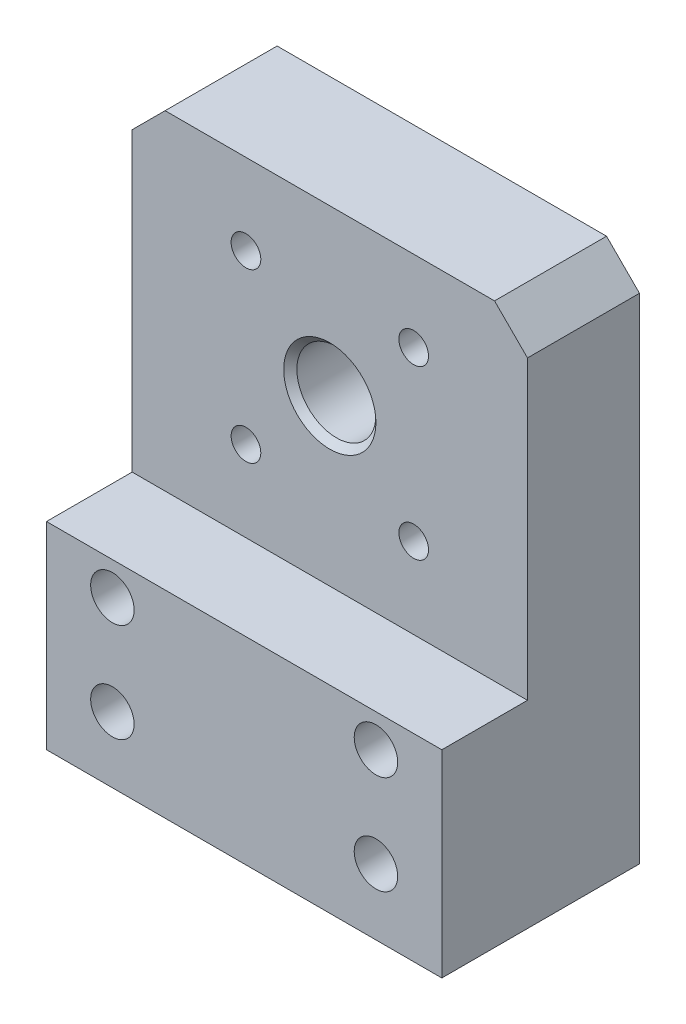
SolidWorks part; units mm, degrees
ref_plane "Face" through (0, 0, 0) normal (0, 0, 1) x (1, 0, 0)
ref_plane "Dessus" through (0, 0, 0) normal (0, 1, 0) x (1, 0, 0)
ref_plane "Droite" through (0, 0, 0) normal (1, 0, 0) x (0, 0, -1)
sketch "Esquisse1" plane through (0, 0, 0) normal (0, 0, 1) x (1, 0, 0)
  line L0 (-30, 25) -> (30, -25) construction
  line L1 (-30, 25) -> (30, 25)
  line L2 (-30, 25) -> (-30, -25)
  line L3 (-30, -25) -> (30, -25)
  line L4 (30, 25) -> (30, -25)
  circle A1 centre (0, 0) radius 6
  dimension "D1" = 60
  dimension "D2" = 12
  dimension "D3" = 50
extrude "Extrusion2" add sketch "Esquisse1" along normal mid plane 17
sketch "Esquisse3" plane through (0, 0, -8.5) normal (0, 0, -1) x (-1, 0, 0)
  line L0 (30, -25) -> (-30, -25) construction
  line L1 (-30, -55) -> (30, -55)
  line L2 (-30, -55) -> (-30, -25)
  line L3 (-30, -25) -> (30, -25)
  line L4 (30, -55) -> (30, -25)
  line L5 (-30, -25) -> (-30, 25) construction
  line L6 (30, 25) -> (30, -25) construction
  dimension "D1" = 30
extrude "Extrusion3" add sketch "Esquisse3" against normal blind 30
hole_wizard "Chambrage pour vis à tête hexagonale M61" positions "Esquisse5" profile "Esquisse4" counterbore size "M6" standard "ISO"
sketch "Esquisse5" plane through (0, 0, -8.5) normal (0, 0, -1) x (-1, 0, 0)
  line L0 (0, -30) -> (0, 0) construction
  line L1 (-20, -30) -> (20, -30) construction
  line L2 (-20, -30) -> (-20, -45) construction
  line L3 (-20, -45) -> (20, -45) construction
  line L4 (20, -30) -> (20, -45) construction
  point P0 (-20, -30)
  point P1 (20, -30)
  point P2 (20, -45)
  point P3 (-20, -45)
  dimension "D1" = 30
  dimension "D2" = 15
  dimension "D3" = 40
sketch "Esquisse4" plane through (20, -30, -8.5) normal (1, 0, 0) x (0, 1, 0)
  line L0 (0, 0) -> (0, 30)
  line L1 (0, 30) -> (3.3, 30)
  line L3 (3.3, 30) -> (3.3, 6)
  line L4 (3.3, 6) -> (5.5, 6)
  line L5 (5.5, 6) -> (5.5, 0)
  line L7 (5.5, 0) -> (0, 0)
  line L11 (0, -6.35) -> (0, 107.95) construction
  dimension "Diamètre du perçage jusqu'au prochain" = 6.6
  dimension "Profondeur du perçage jusqu'au prochain" = 30
  dimension "Diamètre du chambrage" = 11
  dimension "Profondeur du chambrage" = 6
hole_wizard "Dégagement M41" positions "Esquisse10" profile "Esquisse9" hole size "M4" standard "Ansi Métrique"
sketch "Esquisse10" plane through (0, 0, -8.5) normal (0, 0, -1) x (-1, 0, 0)
  line L1 (12.7279, 12.7279) -> (-12.7279, 12.7279) construction
  line L2 (12.7279, 12.7279) -> (12.7279, -12.7279) construction
  line L3 (12.7279, -12.7279) -> (-12.7279, -12.7279) construction
  line L4 (-12.7279, 12.7279) -> (-12.7279, -12.7279) construction
  circle A0 centre (0, 0) radius 18 construction
  point P0 (12.7279, -12.7279)
  point P1 (-12.7279, -12.7279)
  point P2 (12.7279, 12.7279)
  point P3 (-12.7279, 12.7279)
  dimension "D1" = 36
sketch "Esquisse9" plane through (-12.7279, -12.7279, -8.5) normal (1, 0, 0) x (0, 1, 0)
  line L0 (0, 0) -> (0, 30)
  line L1 (0, 30) -> (2.25, 30)
  line L2 (2.25, 30) -> (2.25, 0)
  line L5 (2.25, 0) -> (0, 0)
  line L11 (0, -6.35) -> (0, 107.95) construction
  dimension "Diamètre du perçage jusqu'au prochain" = 4.5
  dimension "Profondeur du perçage jusqu'au prochain" = 30
sketch "Esquisse12" plane through (0, 0, -8.5) normal (0, 0, -1) x (-1, 0, 0)
  circle A0 centre (0, 0) radius 12.5
  dimension "D1" = 25
extrude "Enlèv. mat.-Extru.3" cut sketch "Esquisse12" against normal blind 3
sketch "Esquisse13" plane through (0, 0, -5.5) normal (0, 0, -1) x (-1, 0, 0)
  circle A0 centre (0, 0) radius 10
  dimension "D1" = 20
extrude "Enlèv. mat.-Extru.4" cut sketch "Esquisse13" against normal blind 1.5
chamfer "Chanfrein1" distance 1 angle 45 2 edges at (6, 0, 8.5) (-6, 0, -4)
chamfer "Chanfrein2" distance 5 angle 45 3 edges at (-30, 25, 0) (30, 25, 0)
